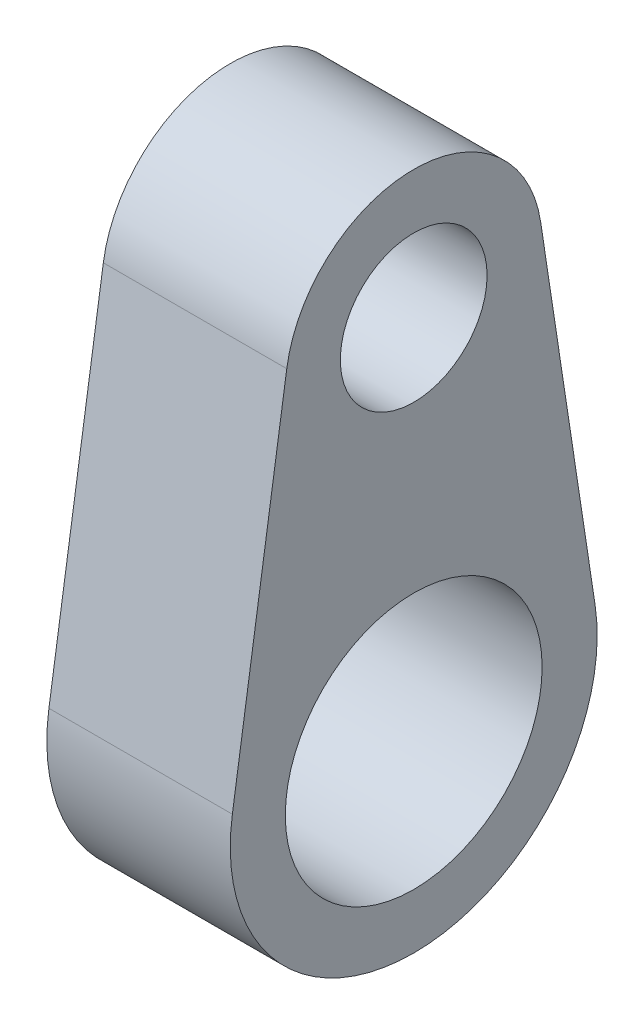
SolidWorks part; units mm, degrees
ref_plane "Front Plane" through (0, 0, 0) normal (0, 0, 1) x (1, 0, 0)
ref_plane "Top Plane" through (0, 0, 0) normal (0, 1, 0) x (1, 0, 0)
ref_plane "Right Plane" through (0, 0, 0) normal (1, 0, 0) x (0, 0, -1)
sketch "Sketch1" plane through (0, 0, 0) normal (1, 0, 0) x (0, 0, -1)
  line L0 (0, -50) -> (0, 50) construction
  line L3 (-17.302, 2.625) -> (-24.7171, -46.25)
  line L4 (17.302, 2.625) -> (24.7171, -46.25)
  circle A0 centre (0, 0) radius 10
  circle A2 centre (0, -50) radius 17.5
  arc A3 (17.302, 2.625) -> (-17.302, 2.625) centre (0, 0) ccw
  arc A5 (-24.7171, -46.25) -> (24.7171, -46.25) centre (0, -50) ccw
  point P4 (0, 0)
  dimension "D2" = 35
  dimension "D3" = 20
  dimension "D6" = 50
  dimension "D7" = 35
  dimension "D1" = 100
extrude "Boss-Extrude1" add sketch "Sketch1" along normal mid plane 25
